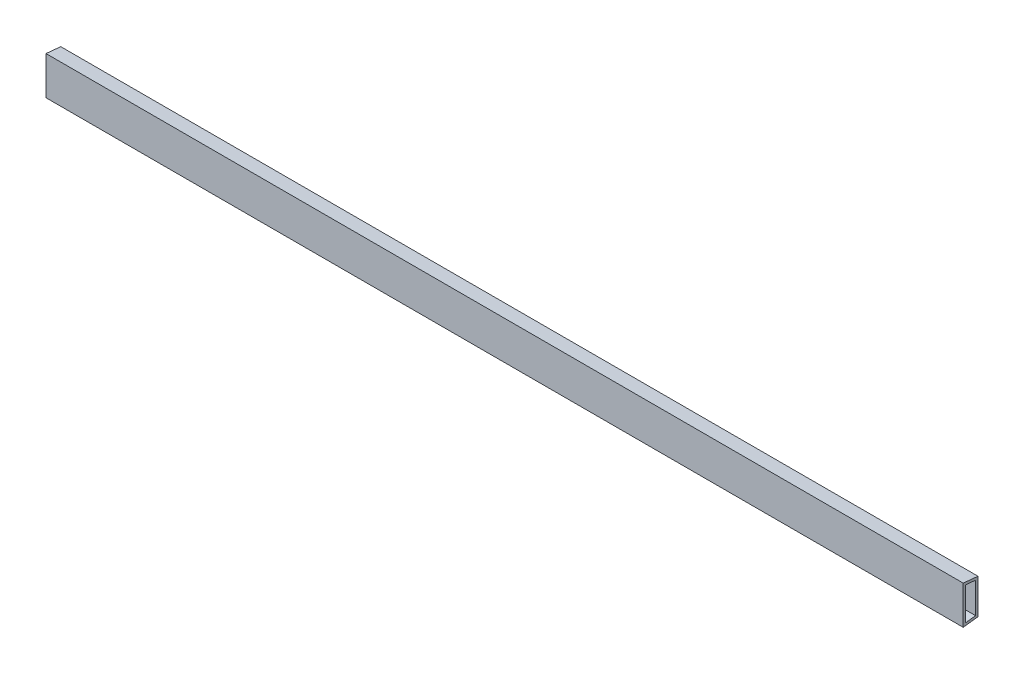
SolidWorks part; units mm, degrees
ref_plane "Front Plane" through (0, 0, 0) normal (0, 0, 1) x (1, 0, 0)
ref_plane "Top Plane" through (0, 0, 0) normal (0, 1, 0) x (1, 0, 0)
ref_plane "Right Plane" through (0, 0, 0) normal (1, 0, 0) x (0, 0, -1)
curve "Curve1"
sketch "Sketch1" plane through (0, 0, 0) normal (1, 0, 0) x (0, 0, -1)
  line L0 (64.2938, 17.9381) -> (64.2938, 7.3735)
  line L1 (0, 0) -> (0, 95.7684) construction
  line L2 (63.5, 18.8083) -> (63.5, 6.4745)
  line L3 (68.2625, 18.3471) -> (68.2625, 7.0409)
  line L4 (67.4688, 17.6298) -> (67.4688, 7.7502)
  spline S0 degree 3 poles (63.5, 6.4745) (64.3094, 6.5766) (65.8963, 6.771) (67.4845, 6.9541) (68.2625, 7.0409) knots 0.725427 0.725427 0.725427 0.725427 0.733427 0.741103 0.741103 0.741103 0.741103
  spline S1 degree 1 poles (64.2938, 7.3735) (67.4688, 7.7502) knots 0 0 1 1 construction
  spline S2 degree 3 poles (68.2625, 18.3471) (67.5841, 18.4164) (65.9971, 18.5752) (64.4093, 18.7256) (63.5, 18.8083) knots 1.263854 1.263854 1.263854 1.263854 1.270541 1.279493 1.279493 1.279493 1.279493
  spline S4 degree 1 poles (67.4688, 17.6298) (64.2938, 17.9381) knots 0 0 1 1 construction
  spline S5 degree 3 poles (64.2938, 7.3735) (65.3515, 7.504) (66.4098, 7.6297) (67.4688, 7.7502) knots 0.728362 0.728362 0.728362 0.728362 0.738787 0.738787 0.738787 0.738787
  spline S6 degree 3 poles (67.4688, 17.6298) (66.4108, 17.7363) (65.3525, 17.8393) (64.2938, 17.9381) knots 1.266201 1.266201 1.266201 1.266201 1.276646 1.276646 1.276646 1.276646
  dimension "D1" = 0.7937
  dimension "D2" = 63.5
  dimension "D3" = 68.2625
extrude "Boss-Extrude1" add sketch "Sketch1" along normal mid plane 295.275
